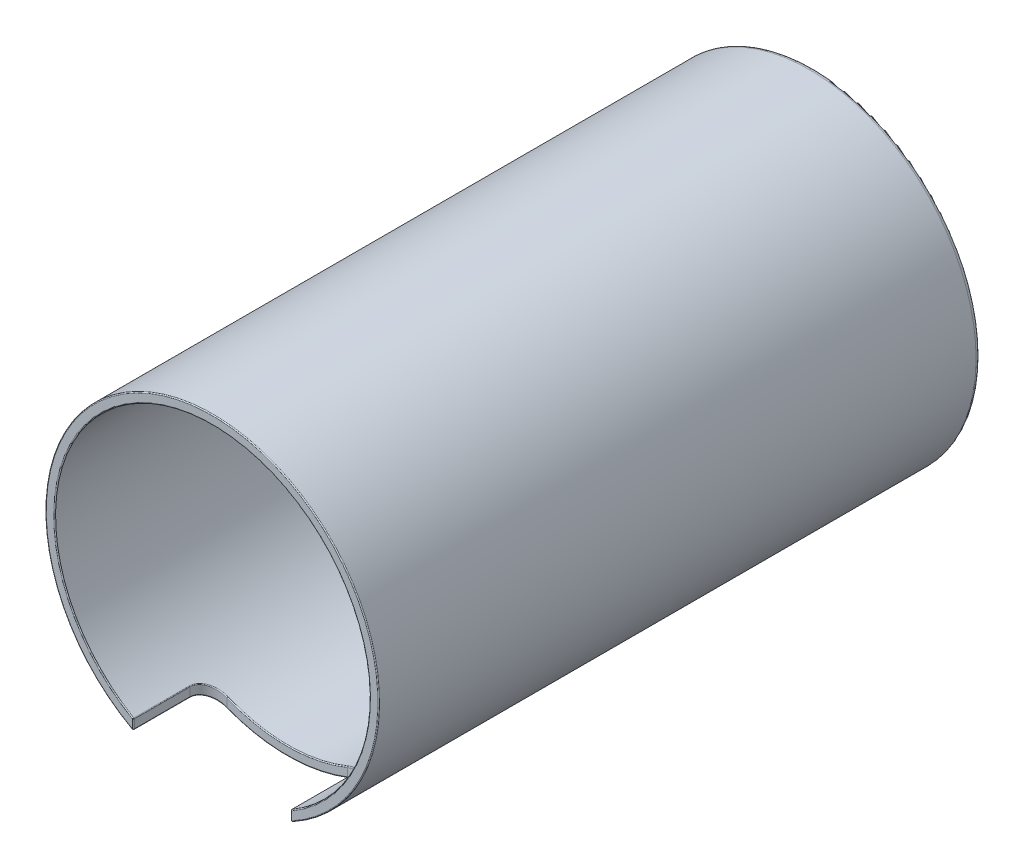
SolidWorks part; units mm, degrees
ref_plane "Plan1" through (0, 0, 0) normal (0, 0, 1) x (1, 0, 0)
ref_plane "Plan2" through (0, 0, 0) normal (0, 1, 0) x (1, 0, 0)
ref_plane "Plan3" through (0, 0, 0) normal (1, 0, 0) x (0, 0, -1)
sketch "Esquisse1" plane through (0, 0, 0) normal (0, 0, 1) x (1, 0, 0)
  circle A0 centre (0, 0) radius 18
  dimension "D1" = 36
extrude "Extrusion1" add sketch "Esquisse1" along normal blind 65
sketch "Esquisse2" plane through (0, 0, 65) normal (0, 0, 1) x (1, 0, 0)
  circle A0 centre (0, 0) radius 17
  dimension "D1" = 34
extrude "Enlèv. mat.-Extru.1" cut sketch "Esquisse2" against normal blind 64
sketch "Esquisse3" plane through (0, 0, 0) normal (0, 0, -1) x (-1, 0, 0)
  circle A0 centre (0, 0) radius 5
  dimension "D1" = 10
extrude "Enlèv. mat.-Extru.2" cut sketch "Esquisse3" against normal blind 64
hole_wizard "Trou taraudé M3x0.51" positions "Esquisse6" profile "Esquisse5" tap size "M3x0.5" standard "ISO"
sketch "Esquisse6" plane through (0, 0, 0) normal (0, 0, -1) x (-1, 0, 0)
  line L0 (0, 0) -> (0, 20.1013) construction
  point P0 (0, 12.5)
  dimension "D1" = 12.5
sketch "Esquisse5" plane through (0, 12.5, 0) normal (1, 0, 0) x (0, 1, 0)
  line L0 (0, 0) -> (0, 9.2511)
  line L1 (0, 9.2511) -> (1.25, 8.5)
  line L2 (1.25, 8.5) -> (1.25, 6)
  line L3 (1.25, 6) -> (1.5, 6)
  line L4 (1.5, 6) -> (1.5, 0)
  line L5 (1.5, 0) -> (0, 0)
  line L10 (0, 9.2511) -> (-1.25, 8.5) construction
  line L11 (0, -6.35) -> (0, 107.95) construction
  dimension "Diamètre du trou pour taraudage" = 2.5
  dimension "Profondeur du trou pour taraudage" = 8.5
  dimension "Diamètre principal du filetage" = 3
  dimension "Profondeur du filetage" = 6
  dimension "Angle de pointe" = 118
pattern_circular "Répétition circulaire1" count 4 over 360
fillet "Congé1" radius 0.5
fillet "Congé2" radius 0.1
sketch "Esquisse7" plane through (0, 0, 0) normal (0, 1, 0) x (1, 0, 0)
  line L0 (0, 0) -> (0, -70.0388) construction
  line L1 (18, -64.9) -> (-18, -64.9) construction
  line L2 (-8.5, -66.2083) -> (8.5, -66.2083)
  line L3 (-8.5, -66.2083) -> (-8.5, -58.9)
  line L4 (-6.5, -56.9) -> (6.5, -56.9)
  line L5 (8.5, -66.2083) -> (8.5, -58.9)
  arc A0 (-6.5, -56.9) -> (-8.5, -58.9) centre (-6.5, -58.9) ccw
  arc A1 (8.5, -58.9) -> (6.5, -56.9) centre (6.5, -58.9) ccw
  dimension "D4" = 2
  dimension "D1" = 8.5
  dimension "D2" = 17
  dimension "D3" = 8
extrude "Enlèv. mat.-Extru.3" cut sketch "Esquisse7" against normal blind 64
fillet "Congé3" radius 0.1
sketch "Esquisse8" plane through (0, 0, 1) normal (0, 0, 1) x (1, 0, 0)
  circle A0 centre (0, 0) radius 5.5
  circle A1 centre (0, 0) radius 7
  dimension "D1" = 11
  dimension "D2" = 1.5
extrude "Extrusion2" add sketch "Esquisse8" along normal blind 4
sketch "Esquisse9" plane through (0, 0, 1) normal (0, 0, 1) x (1, 0, 0)
  circle A0 centre (0, 0) radius 7 construction
  circle A1 centre (0, 0) radius 17
  circle A2 centre (0, 0) radius 17
  circle A3 centre (0, 12.5) radius 1.5 construction
  circle A4 centre (-12.5, 0) radius 1.5 construction
  circle A5 centre (12.5, 0) radius 1.5 construction
  circle A6 centre (0, -12.5) radius 1.5 construction
  circle A7 centre (0, 0) radius 7
  circle A8 centre (0, 12.5) radius 1.5
  circle A9 centre (-12.5, 0) radius 1.5
  circle A10 centre (12.5, 0) radius 1.5
  circle A11 centre (0, -12.5) radius 1.5
  dimension "D1" = 0
extrude "Extrusion3" add sketch "Esquisse9" along normal blind 3
fillet "Congé4" radius 0.3
